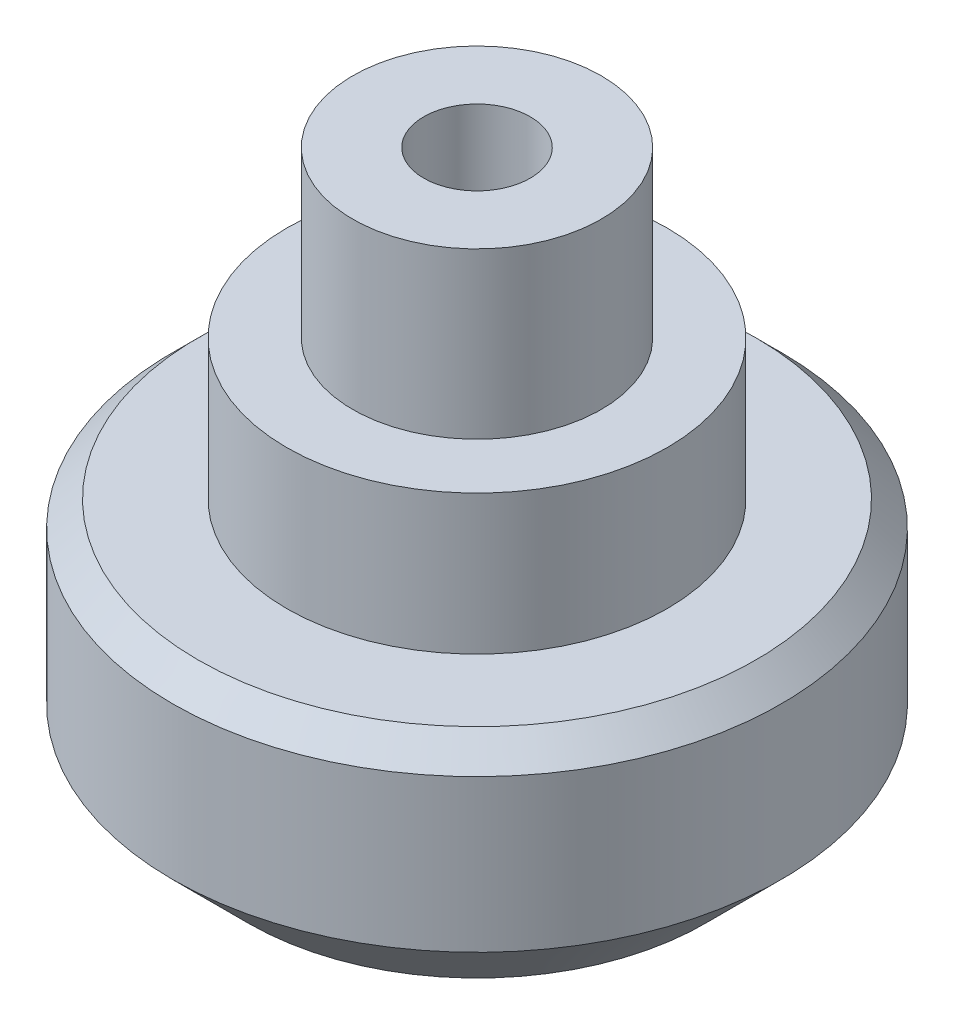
SolidWorks part; units mm, degrees
ref_plane "Front Plane" through (0, 0, 0) normal (0, 0, 1) x (1, 0, 0)
ref_plane "Top Plane" through (0, 0, 0) normal (0, 1, 0) x (1, 0, 0)
ref_plane "Right Plane" through (0, 0, 0) normal (1, 0, 0) x (0, 0, -1)
sketch "Sketch1" plane through (0, 0, 0) normal (0, 1, 0) x (1, 0, 0)
  circle A0 centre (0, 0) radius 12
  dimension "D1" = 24
extrude "Extrude1" add sketch "Sketch1" along normal blind 10
sketch "Sketch2" plane through (0, 10, 0) normal (0, 1, 0) x (1, 0, 0)
  circle A0 centre (0, 0) radius 7.5
  dimension "D1" = 15
extrude "Extrude2" add sketch "Sketch2" along normal blind 5.5
sketch "Sketch3" plane through (0, 15.5, 0) normal (0, 1, 0) x (1, 0, 0)
  circle A0 centre (0, 0) radius 4.9
  dimension "D1" = 9.8
extrude "Extrude3" add sketch "Sketch3" along normal blind 6.5
sketch "Sketch4" plane through (0, 22, 0) normal (0, 1, 0) x (1, 0, 0)
  circle A0 centre (0, 0) radius 2.1
  dimension "D1" = 4.2
extrude "Extrude4" cut sketch "Sketch4" against normal blind 12
sketch "Sketch5" plane through (0, 0, 0) normal (0, -1, 0) x (1, 0, 0)
  circle A0 centre (0, 0) radius 2.5
  dimension "D1" = 5
extrude "Extrude5" cut sketch "Sketch5" against normal blind 10
chamfer "Chamfer1" distance 1 angle 45 1 edges at (0, 10, 12)
chamfer "Chamfer2" distance 3 angle 45 1 edges at (0, 0, 12)
